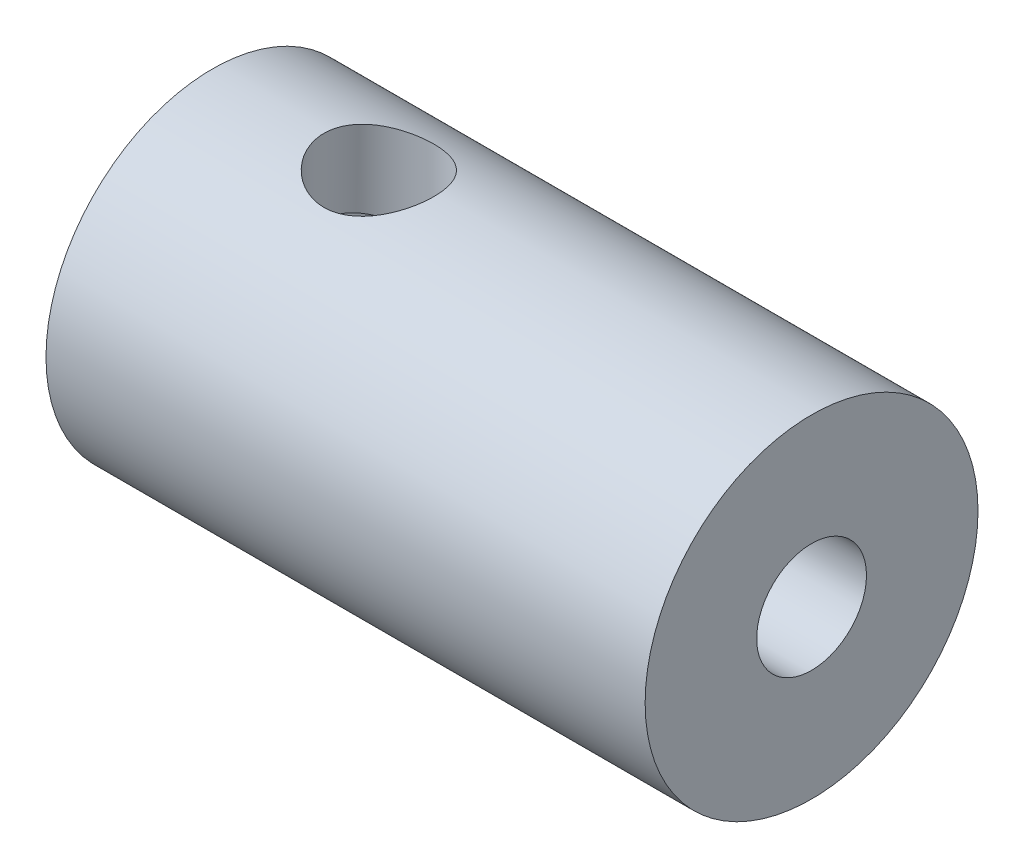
SolidWorks part; units mm, degrees
ref_plane "Front Plane" through (0, 0, 0) normal (0, 0, 1) x (1, 0, 0)
ref_plane "Top Plane" through (0, 0, 0) normal (0, 1, 0) x (1, 0, 0)
ref_plane "Right Plane" through (0, 0, 0) normal (1, 0, 0) x (0, 0, -1)
sketch "Sketch1" plane through (0, 0, 0) normal (1, 0, 0) x (0, 0, -1)
  circle A0 centre (0, 0) radius 5
  dimension "D1" = 10
extrude "Boss-Extrude1" add sketch "Sketch1" along normal blind 18
hole_wizard "M4 Tapped Hole1" positions "Sketch3" profile "Sketch4" tap size "M4" standard "DIN"
sketch "Sketch3" plane through (18, 0, 0) normal (1, 0, 0) x (0, 0, -1)
  point P0 (0, 0)
sketch "Sketch4" plane through (18, 0, 0) normal (0, 1, 0) x (0, 0, -1)
  line L0 (0, 0) -> (0, 18)
  line L1 (0, 18) -> (1.65, 18)
  line L2 (1.65, 18) -> (1.65, 0)
  line L5 (1.65, 0) -> (0, 0)
  line L11 (0, -6.35) -> (0, 107.95) construction
  dimension "Thru Tap Drill Dia." = 3.3
  dimension "Thru Tap Drill Depth" = 18
hole_wizard "Ø5.5 (5.5) Diameter Hole1" positions "Sketch6" profile "Sketch7" hole size "Ø5.5" standard "ISO"
sketch "Sketch6" plane through (0, 0, 0) normal (-1, 0, 0) x (0, 0, 1)
  point P0 (0, 0)
sketch "Sketch7" plane through (0, 0, 0) normal (0, 1, 0) x (0, 0, 1)
  line L0 (0, 0) -> (0, 11.6524)
  line L1 (0, 11.6524) -> (2.75, 10)
  line L2 (2.75, 10) -> (2.75, 0)
  line L5 (2.75, 0) -> (0, 0)
  line L10 (0, 11.6524) -> (-2.75, 10) construction
  line L11 (0, -6.35) -> (0, 107.95) construction
  dimension "Hole Dia." = 5.5
  dimension "Hole Depth" = 10
  dimension "Drill Angle" = 118
hole_wizard "M4 Tapped Hole7" positions "3DSketch4" profile "Sketch13" tap size "M4" standard "DIN"
sketch3d "3DSketch4"
  line L0 (0, 0, 0) -> (0, 5, 0)
  line L1 (0, 5, 0) -> (5, 5, 0)
  circle A0 centre (0, 0, 0) radius 5 construction
  point P0 (5, 5, 0)
  point P6 (5, 0, 0)
  dimension "D1" = 5
sketch "Sketch13" plane through (5, 5, 0) normal (1, 0, 0) x (0, 0, 1)
  line L0 (0, 0) -> (0, 25.9914)
  line L1 (0, 25.9914) -> (1.65, 25)
  line L2 (1.65, 25) -> (1.65, 0)
  line L5 (1.65, 0) -> (0, 0)
  line L10 (0, 25.9914) -> (-1.65, 25) construction
  line L11 (0, -6.35) -> (0, 107.95) construction
  dimension "Tap Drill Dia." = 3.3
  dimension "Tap Drill Depth" = 25
  dimension "Drill Angle" = 118
